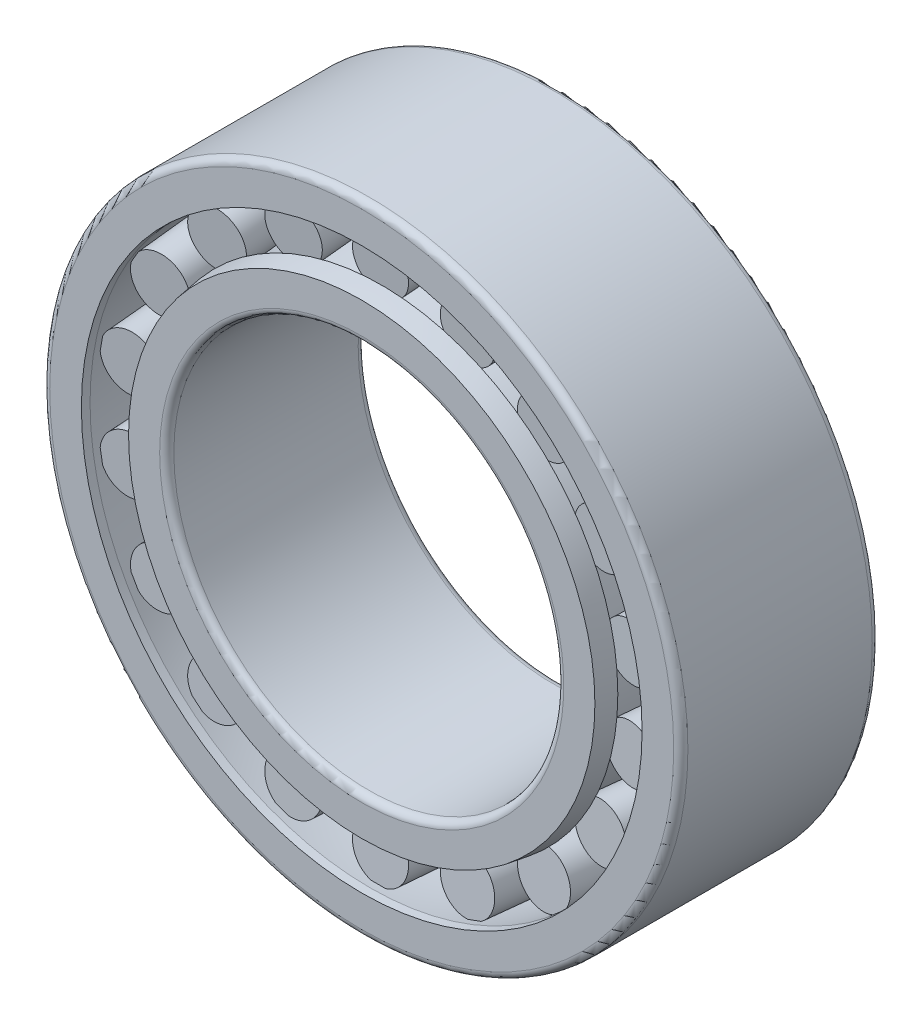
SolidWorks part; units mm, degrees
ref_plane "Front Plane" through (0, 0, 0) normal (0, 0, 1) x (1, 0, 0)
ref_plane "Top Plane" through (0, 0, 0) normal (0, 1, 0) x (1, 0, 0)
ref_plane "Right Plane" through (0, 0, 0) normal (1, 0, 0) x (0, 0, -1)
sketch "BaseSke" plane through (0, 0, 0) normal (1, 0, 0) x (0, 0, -1)
  line L0 (-47.2296, 0) -> (69.4868, 0) construction
  line L2 (0, 129.5214) -> (0, 80.8742) construction
  line L3 (-28, 55) -> (-28, 65.7692) construction
  line L4 (-28, 90) -> (28, 90) construction
  line L5 (-28, 55) -> (28, 55) construction
  line L7 (28, 55) -> (28, 65.7692) construction
  line L8 (28, 78.6923) -> (28, 90) construction
  line L9 (-28, 78.6923) -> (-28, 90) construction
  line L11 (0, 74.4966) -> (-28, 72.2308) construction
  line L12 (0, 74.4966) -> (28, 72.2308) construction
  line L13 (-28, 78.6923) -> (-28, 65.7692) construction
  line L14 (0, 68.119) -> (0, -86.3012) construction
  line L15 (0, 80.8742) -> (0, 68.119) construction
  line L16 (-22.6978, 71.7234) -> (-22.0623, 63.8701) construction
  line L17 (-23.3333, 79.5768) -> (-4.7275, 81.0825)
  line L18 (-23.3333, 79.5768) -> (-22.6978, 71.7234)
  line L19 (-22.0623, 63.8701) -> (-3.4565, 65.3757) construction
  line L20 (-4.7275, 81.0825) -> (-4.092, 73.2291)
  line L21 (-3.4565, 65.3757) -> (-4.092, 73.2291) construction
  line L22 (-22.6978, 71.7234) -> (-4.092, 73.2291)
  line L23 (-28, 71.2944) -> (0, 73.5602) construction
  arc A1 (-28, 78.6923) -> (28, 78.6923) centre (0, -99.881) cw construction
  arc A2 (28, 65.7692) -> (-28, 65.7692) centre (0, -99.881) ccw construction
  dimension "D2" = 10.7692
  dimension "D1" = 168
  dimension "Bearing_Thickness" = 56
  dimension "Bearing_Outside_Diameter" = 180
  dimension "Bearing_Inside_Diameter" = 110
  dimension "D3" = 11.3077
  dimension "D4" = 18.6667
  dimension "D5" = 4.6667
  dimension "D6" = 0.9333
revolve "Roller" add sketch "BaseSke" angle 360 about L23
sketch "OuterRaceSke" plane through (0, 0, 0) normal (1, 0, 0) x (0, 0, -1)
  line L0 (0, 0) -> (0, 94.5438) construction
  line L1 (-28, 90) -> (28, 90)
  line L2 (-28, 90) -> (-28, 78.6721)
  line L3 (28, 90) -> (28, 78.6721)
  line L5 (-50.3916, 0) -> (55.2197, 0) construction
  arc A0 (-28, 78.6721) -> (28, 78.6721) centre (0, -99.881) cw
  arc A2 (28, 78.6923) -> (-28, 78.6923) centre (0, -99.881) ccw construction
  dimension "D1" = 0.02
revolve "OuterRace" add sketch "OuterRaceSke" angle 360 about L5
sketch "InnerRaceSke" plane through (0, 0, 0) normal (1, 0, 0) x (0, 0, -1)
  line L0 (-70.8626, 0) -> (113.5527, 0) construction
  line L1 (0, 90.393) -> (0, -90.393) construction
  line L2 (-28, 55) -> (28, 55)
  line L3 (-28, 55) -> (-28, 65.7692)
  line L4 (-22.3852, 66.621) -> (-22.1636, 63.8819)
  line L5 (-22.1636, 63.8819) -> (-3.3584, 65.4037)
  line L7 (-3.3584, 65.4037) -> (-3.5751, 68.081)
  line L8 (-22.6978, 71.7234) -> (-22.0623, 63.8701) construction
  line L9 (3.3584, 65.4037) -> (3.5751, 68.081)
  line L10 (-3.4565, 65.3757) -> (-4.092, 73.2291) construction
  line L11 (-22.0623, 63.8701) -> (-3.4565, 65.3757) construction
  line L14 (22.1636, 63.8819) -> (3.3584, 65.4037)
  line L15 (22.3852, 66.621) -> (22.1636, 63.8819)
  line L16 (28, 55) -> (28, 65.7692)
  arc A0 (-28, 65.7692) -> (-22.3852, 66.621) centre (0, -99.881) cw
  arc A1 (28, 65.7692) -> (-28, 65.7692) centre (0, -99.881) ccw construction
  arc A2 (-3.5751, 68.081) -> (3.5751, 68.081) centre (0, -99.881) cw
  arc A3 (28, 65.7692) -> (22.3852, 66.621) centre (0, -99.881) ccw
  point P38 (0, 55)
  dimension "D2" = 0.1
  dimension "D1" = 0.02
  dimension "D3" = 0.1
revolve "InnerRace" add sketch "InnerRaceSke" angle 360 about L0
mirror "MirrorRoller" about plane through (0, 0, 0) normal (0, 0, 1) of "Roller"
fillet "Fillet1" radius 2 4 edges at (55, 0, 28) (90, 0, 28) (55, 0, -28) (90, 0, -28)
sketch "CutGrooveSke" plane through (0, 0, 0) normal (1, 0, 0) x (0, 0, -1)
  line L0 (-51.8407, 0) -> (83.8302, 0) construction
  line L1 (-14, -108.2) -> (-16.8, -108.2)
  line L2 (-14, -108.2) -> (-14, -88.2)
  line L3 (-14, -88.2) -> (-16.8, -88.2)
  line L4 (-16.8, -108.2) -> (-16.8, -88.2)
  dimension "D1" = 88.2
  dimension "D2" = 14
  dimension "D3" = 2.8
  dimension "D4" = 20
revolve "CutGroove" [suppressed] cut sketch "CutGrooveSke" angle 360 about L0
sketch "TaperSke" plane through (0, 0, 0) normal (1, 0, 0) x (0, 0, -1)
  line L0 (-28, 55) -> (28, 55)
  line L1 (28, 55) -> (28, 59.6667)
  line L2 (28, 59.6667) -> (-28, 55)
  line L7 (-41.2502, 0) -> (40.8606, 0) construction
  dimension "Taper" = 4.6667
revolve "Taper" [suppressed] cut sketch "TaperSke" angle 360 about L7
fillet "Fillet2" [suppressed] radius 2
pattern_circular "CirPatternBall" count 18 over 360 about axis through (0, 0, 0) along (0, 0, 1) of "Roller", "MirrorRoller"
sketch "SimplifiedSke" plane through (0, 0, 0) normal (1, 0, 0) x (0, 0, -1)
  line L0 (37.5911, 0) -> (-37.5911, 0) construction
  line L1 (0, 0) -> (0, 96.8272) construction
  line L2 (-22.0623, 63.8701) -> (-3.4565, 65.3757)
  line L3 (-22.0623, 63.8701) -> (-23.3333, 79.5768)
  line L4 (-23.3333, 79.5768) -> (-4.7275, 81.0825)
  line L5 (-3.4565, 65.3757) -> (-4.7275, 81.0825)
  line L7 (3.4565, 65.3757) -> (4.7275, 81.0825)
  line L8 (22.0623, 63.8701) -> (3.4565, 65.3757)
  line L9 (22.0623, 63.8701) -> (23.3333, 79.5768)
  line L10 (23.3333, 79.5768) -> (4.7275, 81.0825)
revolve "Simplified" [suppressed] add sketch "SimplifiedSke" angle 360 about L0
chamfer "Chamfer" distance 2.3333 angle 10 2 edges at (78.6721, 0, -28) (78.6721, 0, 28)
equation "\"D1@BaseSke\" = \"Bearing_Thickness@BaseSke\"*3"
equation "\"D2@BaseSke\" =  ( \"Bearing_Outside_Diameter@BaseSke\" - \"Bearing_Inside_Diameter@BaseSke\" ) /6.5"
equation "\"D3@BaseSke\" = \"D2@BaseSke\"*1.05"
equation "\"D4@BaseSke\" = \"Bearing_Thickness@BaseSke\"/3"
equation "\"D5@BaseSke\" = \"Bearing_Thickness@BaseSke\"/12"
equation "\"D6@BaseSke\" = \"Bearing_Thickness@BaseSke\"/60"
equation "\"D1@CutGrooveSke\" = \"Bearing_Outside_Diameter@BaseSke\" * 0.49"
equation "\"D2@CutGrooveSke\" = \"Bearing_Thickness@BaseSke\" *0.25"
equation "\"D3@CutGrooveSke\" = \"Bearing_Thickness@BaseSke\"/20"
equation "\"Taper@TaperSke\" = \"Bearing_Thickness@BaseSke\"/12"
equation "\"D1@Fillet2\" = \"Fillet_radius@Fillet1\""
equation "\"D1@CirPatternBall\" =  int(  ( \"Bearing_Outside_Diameter@BaseSke\" + \"Bearing_Inside_Diameter@BaseSke\" )  / 2 *  pi  /  ( \"Bearing_Outside_Diameter@BaseSke\" - \"Bearing_Inside_Diameter@BaseSke\" ) * 2.8 "
equation "\"D1@Chamfer\" = \"Bearing_Thickness@BaseSke\"/24"
